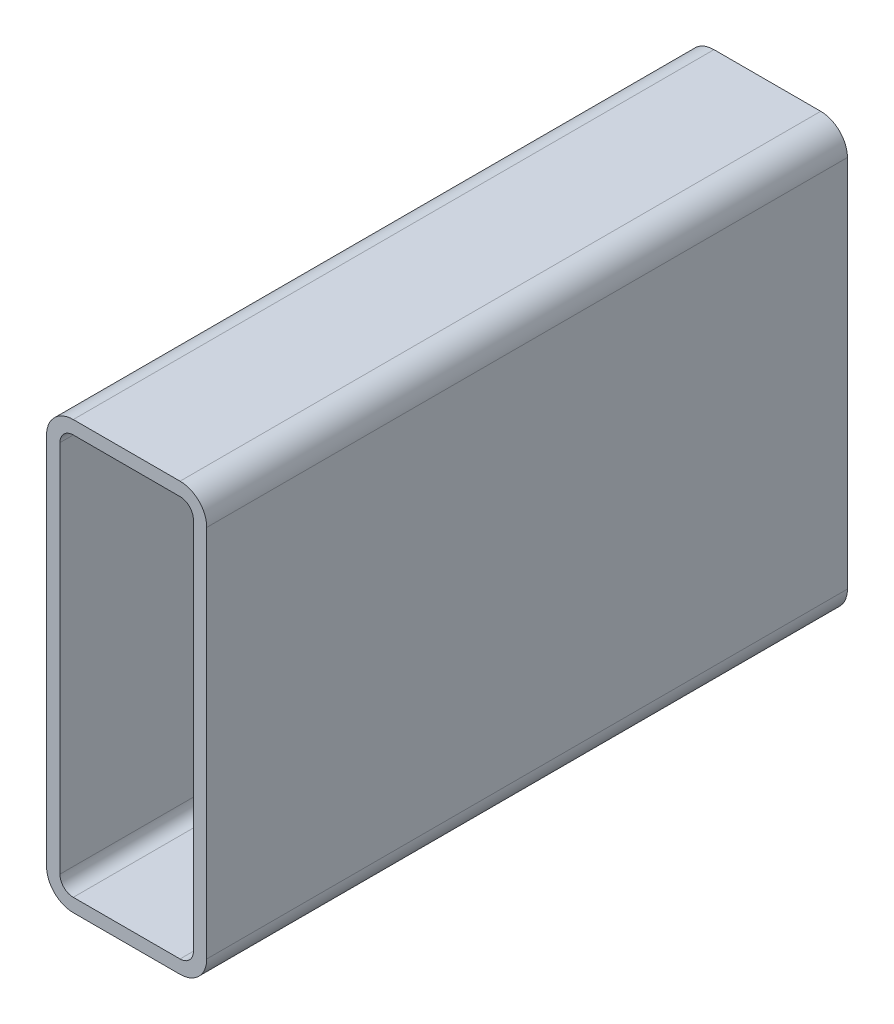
SolidWorks part; units mm, degrees
ref_plane "Front Plane" through (0, 0, 0) normal (0, 0, 1) x (1, 0, 0)
ref_plane "Top Plane" through (0, 0, 0) normal (0, 1, 0) x (1, 0, 0)
ref_plane "Right Plane" through (0, 0, 0) normal (1, 0, 0) x (0, 0, -1)
sketch "Sketch1" plane through (0, 0, 0) normal (0, 0, 1) x (1, 0, 0)
sketch_block_instance "HSS8x3x0.250-1"
sketch_block "HSS8x3x0.250"
extrude "Boss-Extrude1" add sketch "Sketch1" along normal blind 304.8
